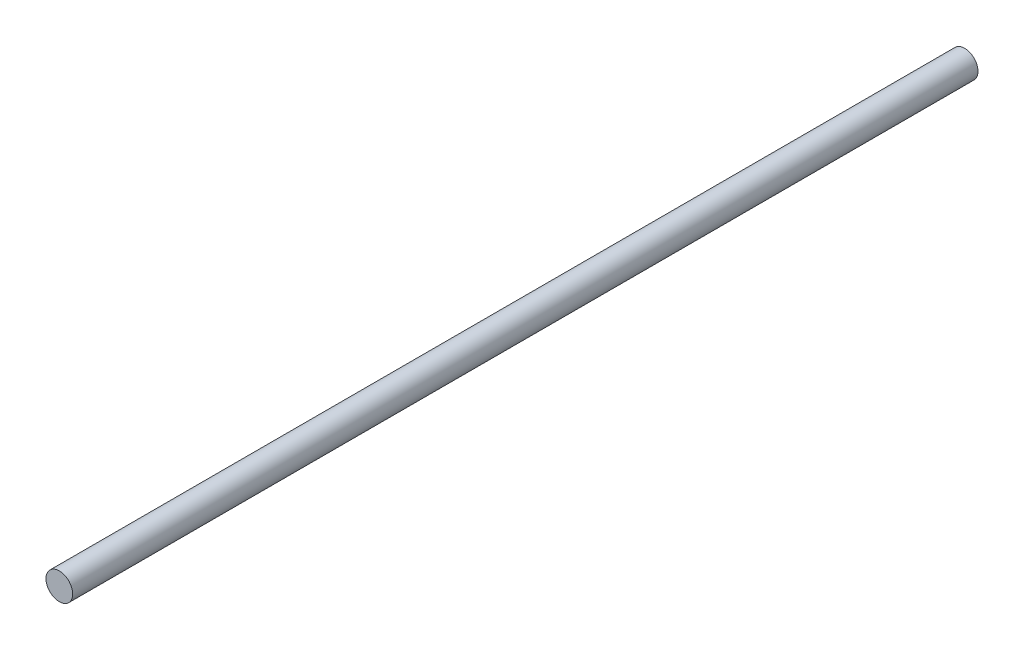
SolidWorks part; units mm, degrees
ref_plane "前视基准面" through (0, 0, 0) normal (0, 0, 1) x (1, 0, 0)
ref_plane "上视基准面" through (0, 0, 0) normal (0, 1, 0) x (1, 0, 0)
ref_plane "右视基准面" through (0, 0, 0) normal (1, 0, 0) x (0, 0, -1)
other "Configuration Table"
sketch "草图1" plane through (0, 0, 0) normal (0, 0, 1) x (1, 0, 0)
  circle A0 centre (0, 0) radius 2.95
  dimension "D1" = 5.9
extrude "凸台-拉伸1" add sketch "草图1" against normal blind 196
sketch "草图2" plane through (0, 0, 0) normal (0, 0, 1) x (1, 0, 0)
  circle A0 centre (0, 0) radius 2.95
extrude "凸台-拉伸2" add sketch "草图2" along normal blind 4
